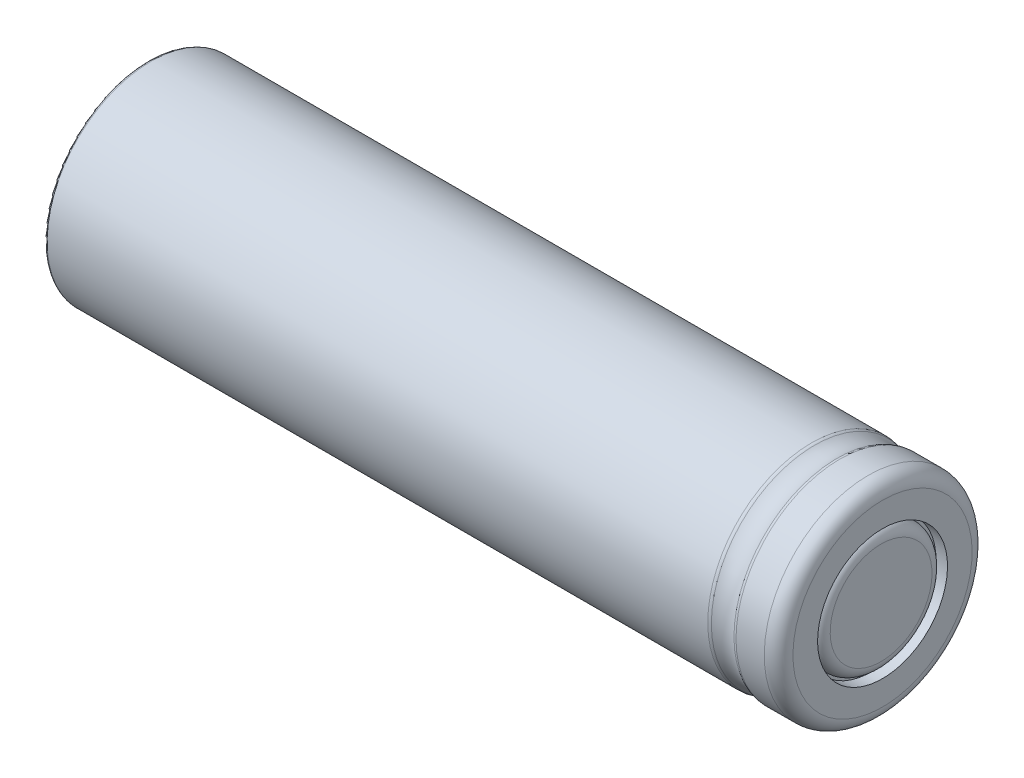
SolidWorks part; units mm, degrees
ref_plane "Front" through (0, 0, 0) normal (0, 0, 1) x (1, 0, 0)
ref_plane "Top" through (0, 0, 0) normal (0, 1, 0) x (1, 0, 0)
ref_plane "Right" through (0, 0, 0) normal (1, 0, 0) x (0, 0, -1)
sketch "Sketch1" plane through (0, 0, 0) normal (0, 0, 1) x (1, 0, 0)
  line L0 (0, 0) -> (0, 8.946)
  line L1 (0.254, 9.2) -> (63.73, 9.2)
  line L2 (65, 7.93) -> (65, 0)
  line L3 (65, 0) -> (0, 0)
  arc A0 (0.254, 9.2) -> (0, 8.946) centre (0.254, 8.946) ccw
  arc A1 (65, 7.93) -> (63.73, 9.2) centre (63.73, 7.93) ccw
  dimension "D1" = 0.254
  dimension "D4" = 1.27
  dimension "D2" = 65
  dimension "D3" = 9.2
revolve "base" add sketch "Sketch1" angle 360 about L3
sketch "Sketch2" plane through (0, 0, 0) normal (0, 0, 1) x (1, 0, 0)
  line L0 (63.73, 9.2) -> (61.23, 9.2)
  line L2 (0, 0) -> (64.5761, 0) construction
  line L3 (61.23, 9.2) -> (58.73, 9.2)
  line L4 (58.73, 9.2) -> (0, 9.2)
  arc A0 (60.98, 9.133) -> (58.98, 9.133) centre (59.98, 10.8651) cw
  arc A1 (58.98, 9.133) -> (58.73, 9.2) centre (58.73, 8.7) ccw
  arc A2 (61.23, 9.2) -> (60.98, 9.133) centre (61.23, 8.7) ccw
  point P0 (63.73, 9.2)
  dimension "D1" = 0.5
  dimension "D3" = 2
  dimension "D2" = 2.5
  dimension "D4" = 2.5
revolve "+ notch" cut sketch "Sketch2" angle 360 about L2
sketch "Sketch3" plane through (65, 0, 0) normal (1, 0, 0) x (0, 0, -1)
  circle A0 centre (0, 0) radius 5.75
  dimension "D1" = 11.5
extrude "Extrude1" cut sketch "Sketch3" against normal blind 1.016
sketch "Sketch4" plane through (63.984, 0, 0) normal (1, 0, 0) x (0, 0, -1)
  circle A0 centre (0, 0) radius 5.5
  dimension "D1" = 11
extrude "Extrude3" add sketch "Sketch4" along normal offset from surface (0.889 mm away) 0.127
sketch "Sketch5" plane through (0, 0, 0) normal (-1, 0, 0) x (0, 0, 1)
  circle A0 centre (0, 0) radius 7.5
  dimension "D1" = 15
extrude "Extrude4" cut sketch "Sketch5" against normal blind 0.0254
fillet "Fillet1" radius 1 1 edges at (64.873, 5.5, 0)
